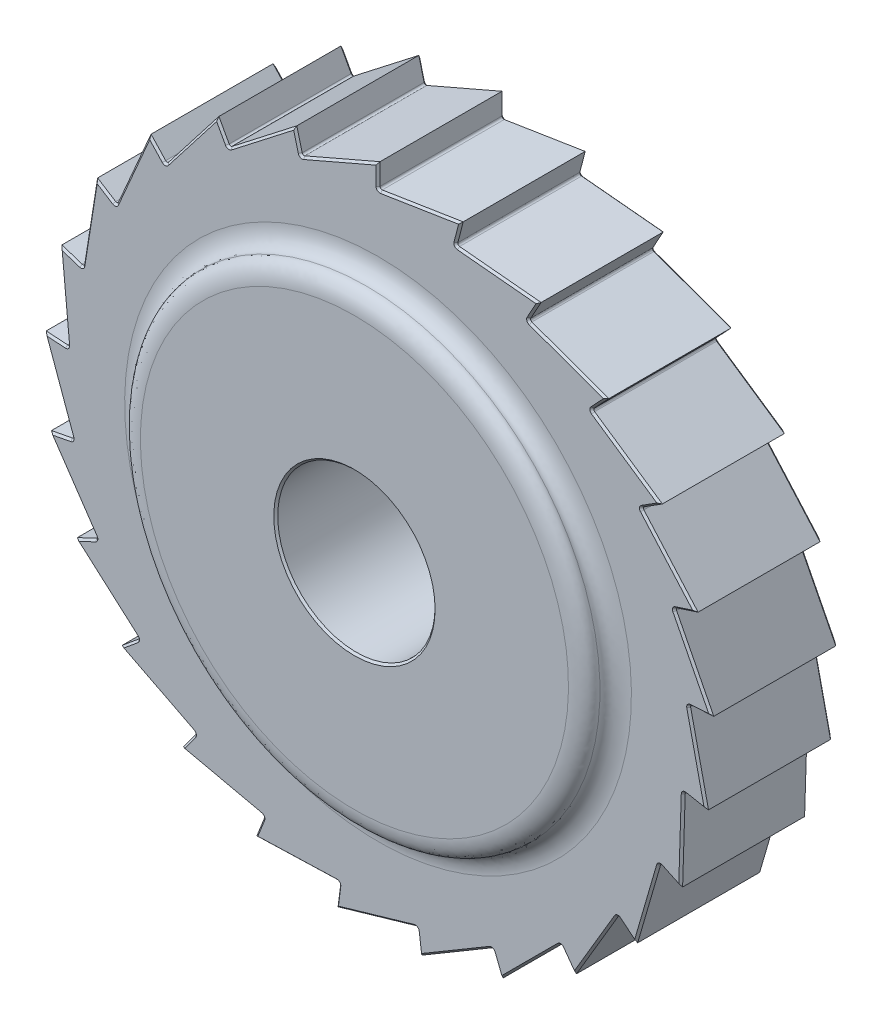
SolidWorks part; units mm, degrees
ref_plane "Спереди" through (0, 0, 0) normal (0, 0, 1) x (1, 0, 0)
ref_plane "Сверху" through (0, 0, 0) normal (0, 1, 0) x (1, 0, 0)
ref_plane "Справа" through (0, 0, 0) normal (1, 0, 0) x (0, 0, -1)
sketch "Эскиз1" plane through (0, 0, 0) normal (0, 0, 1) x (1, 0, 0)
  line L0 (0, 0) -> (0, 42.5) construction
  line L1 (0, 42.5) -> (0, 39.4908)
  line L2 (0, 39.4908) -> (10.5693, 41.1648)
  line L3 (10.5693, 41.1648) -> (9.821, 38.2501)
  line L4 (9.821, 38.2501) -> (20.4745, 37.243)
  line L5 (20.4745, 37.243) -> (19.0248, 34.606)
  line L6 (19.0248, 34.606) -> (29.0933, 30.9812)
  line L7 (29.0933, 30.9812) -> (27.0333, 28.7875)
  line L8 (27.0333, 28.7875) -> (35.8839, 22.7726)
  line L9 (35.8839, 22.7726) -> (33.3432, 21.1602)
  line L10 (33.3432, 21.1602) -> (40.4199, 13.1332)
  line L11 (40.4199, 13.1332) -> (37.558, 12.2033)
  line L12 (37.558, 12.2033) -> (42.4161, 2.6686)
  line L13 (42.4161, 2.6686) -> (39.4128, 2.4796)
  line L14 (39.4128, 2.4796) -> (41.7472, -7.9637)
  line L15 (41.7472, -7.9637) -> (38.7913, -7.3998)
  line L16 (38.7913, -7.3998) -> (38.4551, -18.0956)
  line L17 (38.4551, -18.0956) -> (35.7323, -16.8144)
  line L18 (35.7323, -16.8144) -> (32.7468, -27.0905)
  line L19 (32.7468, -27.0905) -> (30.4282, -25.1724)
  line L20 (30.4282, -25.1724) -> (24.9809, -34.3832)
  line L21 (24.9809, -34.3832) -> (23.2121, -31.9487)
  line L22 (23.2121, -31.9487) -> (15.6453, -39.5155)
  line L23 (15.6453, -39.5155) -> (14.5375, -36.7176)
  line L24 (14.5375, -36.7176) -> (5.3267, -42.1649)
  line L25 (5.3267, -42.1649) -> (4.9495, -39.1794)
  line L26 (4.9495, -39.1794) -> (-5.3267, -42.1649)
  line L27 (-5.3267, -42.1649) -> (-4.9495, -39.1794)
  line L28 (-4.9495, -39.1794) -> (-15.6453, -39.5155)
  line L29 (-15.6453, -39.5155) -> (-14.5375, -36.7176)
  line L30 (-14.5375, -36.7176) -> (-24.9809, -34.3832)
  line L31 (-24.9809, -34.3832) -> (-23.2121, -31.9487)
  line L32 (-23.2121, -31.9487) -> (-32.7468, -27.0905)
  line L33 (-32.7468, -27.0905) -> (-30.4282, -25.1724)
  line L34 (-30.4282, -25.1724) -> (-38.4551, -18.0956)
  line L35 (-38.4551, -18.0956) -> (-35.7323, -16.8144)
  line L36 (-35.7323, -16.8144) -> (-41.7472, -7.9637)
  line L37 (-41.7472, -7.9637) -> (-38.7913, -7.3998)
  line L38 (-38.7913, -7.3998) -> (-42.4161, 2.6686)
  line L39 (-42.4161, 2.6686) -> (-39.4128, 2.4796)
  line L40 (-39.4128, 2.4796) -> (-40.4199, 13.1332)
  line L41 (-40.4199, 13.1332) -> (-37.558, 12.2033)
  line L42 (-37.558, 12.2033) -> (-35.8839, 22.7726)
  line L43 (-35.8839, 22.7726) -> (-33.3432, 21.1602)
  line L44 (-33.3432, 21.1602) -> (-29.0933, 30.9812)
  line L45 (-29.0933, 30.9812) -> (-27.0333, 28.7875)
  line L46 (-27.0333, 28.7875) -> (-20.4745, 37.243)
  line L47 (-20.4745, 37.243) -> (-19.0248, 34.606)
  line L48 (-19.0248, 34.606) -> (-10.5693, 41.1648)
  line L49 (-10.5693, 41.1648) -> (-9.821, 38.2501)
  line L50 (-9.821, 38.2501) -> (0, 42.5)
  circle A0 centre (0, 0) radius 10
  circle A1 centre (0, 0) radius 42.5 construction
  dimension "D1" = 20
  dimension "D2" = 85
  dimension "D3" = 81
  dimension "D5" = 25
extrude "Бобышка-Вытянуть1" add sketch "Эскиз1" along normal blind 16
sketch "Эскиз2" plane through (0, 0, 0) normal (1, 0, 0) x (0, 0, -1)
  line L0 (-16, 0) -> (-19, 0) construction
  line L1 (-16, -7.9637) -> (-16, 2.4796) construction
  line L2 (-19, 10) -> (-19, 27.2)
  line L3 (-16, 2.6686) -> (-16, 12.2033) construction
  line L4 (-17.5, 24.7) -> (-17.5, 29.7) construction
  line L5 (-17.5, 29.7) -> (-17.5, 34.7) construction
  line L6 (-16, 32.2) -> (-16, 10)
  line L7 (-19, 10) -> (-16, 10)
  ellipse E0 centre (-17.5, 27.2) end of major axis (-17.5, 24.7) minor radius 1.5 (-17.5, 29.7) -> (-19, 27.2) ccw
  ellipse E1 centre (-17.5, 32.2) end of major axis (-17.5, 29.7) minor radius 1.5 (-17.5, 29.7) -> (-16, 32.2) ccw
  dimension "D1" = 3
  dimension "D2" = 1.5
  dimension "D3" = 1.5
  dimension "D4" = 32.2
  dimension "D5" = 2.5
  dimension "D6" = 2.5
  dimension "D7" = 20
revolve "Повернуть1" add sketch "Эскиз2" angle 360 about L0
fillet "Скругление1" radius 0.25 25 edges at (-39.4128, 2.4796, 8) (-38.7913, -7.3998, 8) (-35.7323, -16.8144, 8) (-30.4282, -25.1724, 8) (-23.2121, -31.9487, 8) (-14.5375, -36.7176, 8) (-4.9495, -39.1794, 8) (4.9495, -39.1794, 8) (14.5375, -36.7176, 8) (23.2121, -31.9487, 8) (30.4282, -25.1724, 8) (35.7323, -16.8144, 8) (38.7913, -7.3998, 8) (39.4128, 2.4796, 8) (37.558, 12.2033, 8) (33.3432, 21.1602, 8) (27.0333, 28.7875, 8) (19.0248, 34.606, 8) (9.821, 38.2501, 8) (-37.558, 12.2033, 8) (-33.3432, 21.1602, 8) (-27.0333, 28.7875, 8) (-19.0248, 34.606, 8) (-9.821, 38.2501, 8) (0, 39.4908, 8)
chamfer "Фаска1" distance 0.25 angle 45 152 edges at (0, 41.1417, 0) (-4.7762, 40.4332, 0) (-10.2315, 39.8492, 0) (-14.6814, 37.9751, 0) (-19.8202, 36.0528, 0) (-23.6642, 33.1309, 0) (-28.1635, 29.991, 0) (-31.1601, 26.205, 0) (-34.7371, 22.0448, 0) (-36.698, 17.6325, 0) (-39.1281, 12.7135, 0) (-39.9301, 7.9521, 0) (-41.0606, 2.5833, 0) (-40.6533, -2.2279, 0) (-40.413, -7.7092, 0) (-38.822, -12.268, 0) (-37.2262, -17.5173, 0) (-34.5514, -21.5372, 0) (-31.7003, -26.2247, 0) (-28.1099, -29.4532, 0) (-24.1825, -33.2844, 0) (-19.902, -35.5185, 0) (-15.1453, -38.2526, 0) (-10.4437, -39.352, 0) (-5.1564, -40.8173, 0) (-0.3291, -40.713, 0) (5.1564, -40.8173, 0) (9.8061, -39.5157, 0) (15.1453, -38.2526, 0) (19.3252, -35.8356, 0) (24.1825, -33.2844, 0) (27.63, -29.9038, 0) (31.7003, -26.2247, 0) (34.1987, -22.093, 0) (37.2262, -17.5173, 0) (38.6186, -12.894, 0) (40.413, -7.7092, 0) (40.612, -2.8849, 0) (41.0606, 2.5833, 0) (40.0535, 7.3056, 0) (39.1281, 12.7135, 0) (36.9783, 17.0369, 0) (34.7371, 22.0448, 0) (31.5797, 25.6978, 0) (28.1635, 29.991, 0) (24.1967, 32.744, 0) (19.8202, 36.0528, 0) (15.2934, 37.7328, 0) (10.2315, 39.8492, 0) (5.4292, 40.3507, 0) (10.2315, 39.8492, 16) (15.2934, 37.7328, 16) (19.8202, 36.0528, 16) (24.1967, 32.744, 16) (28.1635, 29.991, 16) (31.5797, 25.6978, 16) (34.7371, 22.0448, 16) (36.9783, 17.0369, 16) (39.1281, 12.7135, 16) (40.0535, 7.3056, 16) (41.0606, 2.5833, 16) (40.612, -2.8849, 16) (40.413, -7.7092, 16) (38.6186, -12.894, 16) (37.2262, -17.5173, 16) (34.1987, -22.093, 16) (31.7003, -26.2247, 16) (27.63, -29.9038, 16) (24.1825, -33.2844, 16) (19.3252, -35.8356, 16) (15.1453, -38.2526, 16) (9.8061, -39.5157, 16) (5.1564, -40.8173, 16) (-0.3291, -40.713, 16) (-5.1564, -40.8173, 16) (-10.4437, -39.352, 16) (-15.1453, -38.2526, 16) (-19.902, -35.5185, 16) (-24.1825, -33.2844, 16) (-28.1099, -29.4532, 16) (-31.7003, -26.2247, 16) (-34.5514, -21.5372, 16) (-37.2262, -17.5173, 16) (-38.822, -12.268, 16) (-40.413, -7.7092, 16) (-40.6533, -2.2279, 16) (-41.0606, 2.5833, 16) (-39.9301, 7.9521, 16) (-39.1281, 12.7135, 16) (-36.698, 17.6325, 16) (-34.7371, 22.0448, 16) (-31.1601, 26.205, 16) (-28.1635, 29.991, 16) (-23.6642, 33.1309, 16) (-19.8202, 36.0528, 16) (-14.6814, 37.9751, 16) (-10.2315, 39.8492, 16) (-4.7762, 40.4332, 16) (0, 41.1417, 16) (5.4292, 40.3507, 16) (0, 10, 19) (10, 0, 0) (0.0876, 39.5934, 0) (-9.7616, 38.3713, 0) (-18.9975, 34.7382, 0) (-27.0396, 28.9223, 0) (-33.3828, 21.2892, 0) (-37.6285, 12.3184, 0) (-39.5097, 2.5736, 0) (-38.9085, -7.333, 0) (-35.8625, -16.7787, 0) (-30.5631, -25.1702, 0) (-23.3433, -31.9802, 0) (-14.6568, -36.7807, 0) (-5.0493, -39.2702, 0) (4.8754, -39.2922, 0) (14.4938, -36.8453, 0) (23.2015, -32.0832, 0) (30.4514, -25.3053, 0) (35.7878, -16.9373, 0) (38.8757, -7.5051, 0) (39.5208, 2.3986, 0) (37.6826, 12.1517, 0) (33.4768, 21.1412, 0) (27.1674, 28.8023, 0) (19.1511, 34.6537, 0) (9.9314, 38.3277, 0) (9.9314, 38.3277, 16) (19.1511, 34.6537, 16) (27.1674, 28.8023, 16) (33.4768, 21.1412, 16) (37.6826, 12.1517, 16) (39.5208, 2.3986, 16) (38.8757, -7.5051, 16) (35.7878, -16.9373, 16) (30.4514, -25.3053, 16) (23.2015, -32.0832, 16) (14.4938, -36.8453, 16) (4.8754, -39.2922, 16) (-5.0493, -39.2702, 16) (-14.6568, -36.7807, 16) (-23.3433, -31.9802, 16) (-30.5631, -25.1702, 16) (-35.8625, -16.7787, 16) (-38.9085, -7.333, 16) (-39.5097, 2.5736, 16) (-37.6285, 12.3184, 16) (-33.3828, 21.2892, 16) (-27.0396, 28.9223, 16) (-18.9975, 34.7382, 16) (-9.7616, 38.3713, 16) (0.0876, 39.5934, 16)
